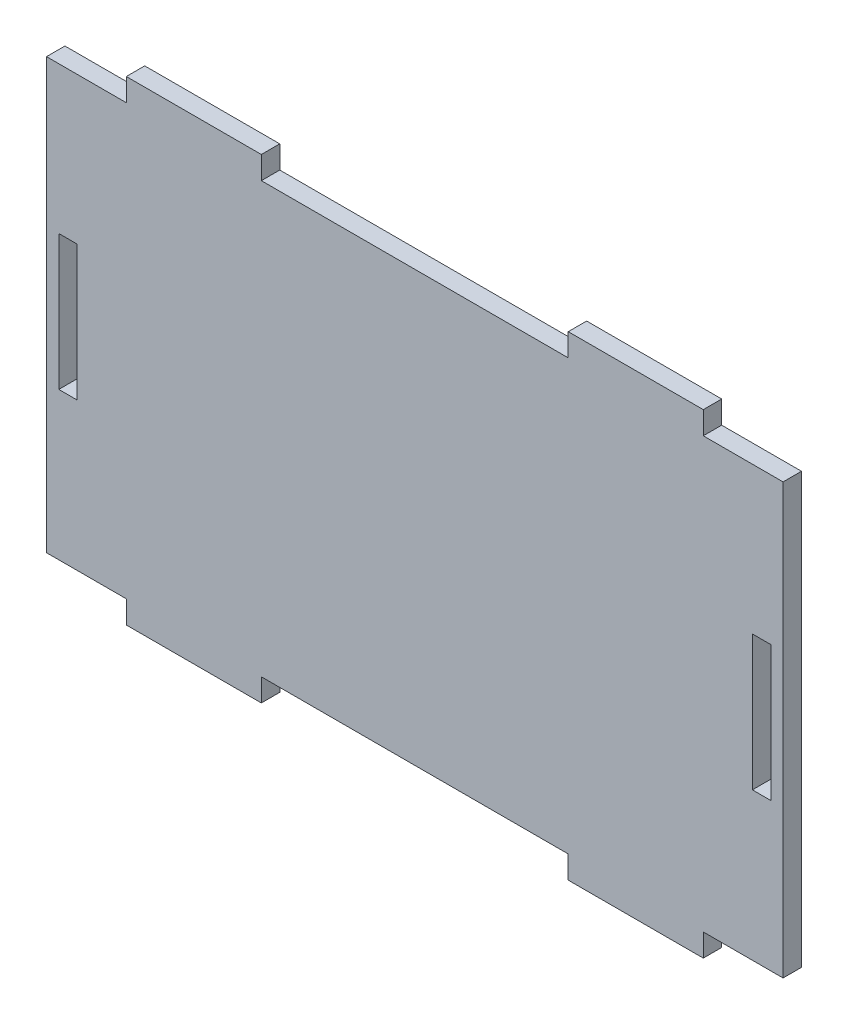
SolidWorks part; units mm, degrees
ref_plane "Front Plane" through (0, 0, 0) normal (0, 0, 1) x (1, 0, 0)
ref_plane "Top Plane" through (0, 0, 0) normal (0, 1, 0) x (1, 0, 0)
ref_plane "Right Plane" through (0, 0, 0) normal (1, 0, 0) x (0, 0, -1)
sketch "Sketch1" plane through (0, 0, 0) normal (0, 0, 1) x (1, 0, 0)
  line L0 (60, 0) -> (60, -17.6209) construction
  line L1 (0, 0) -> (13, 0)
  line L2 (0, 0) -> (0, 70)
  line L3 (0, 70) -> (13, 70)
  line L4 (120, 0) -> (120, 70)
  line L5 (44.5317, 0) -> (85, 0)
  line L6 (35, 0) -> (44.5317, 0)
  line L7 (13, 0) -> (13, -3.696)
  line L8 (35, -3.696) -> (13, -3.696)
  line L9 (35, 0) -> (35, -3.696)
  line L10 (0, 35) -> (5, 35) construction
  line L11 (85, 0) -> (85, -3.696)
  line L12 (85, -3.696) -> (107, -3.696)
  line L13 (107, 0) -> (107, -3.696)
  line L14 (85, 0) -> (75.4683, 0)
  line L15 (107, 0) -> (120, 0)
  line L16 (107, 70) -> (107, 73.696)
  line L17 (85, 73.696) -> (107, 73.696)
  line L18 (85, 70) -> (85, 73.696)
  line L19 (13, 70) -> (13, 73.696)
  line L20 (35, 70) -> (35, 73.696)
  line L21 (35, 73.696) -> (13, 73.696)
  line L22 (35, 70) -> (85, 70)
  line L23 (107, 70) -> (120, 70)
  line L24 (60, 70) -> (60, 0) construction
  line L25 (2, 46.0461) -> (5, 46.0461)
  line L26 (2, 46.0461) -> (2, 24.0461)
  line L27 (2, 24.0461) -> (5, 24.0461)
  line L28 (5, 46.0461) -> (5, 24.0461)
  line L29 (118, 46.0461) -> (115, 46.0461)
  line L30 (118, 46.0461) -> (118, 24.0461)
  line L31 (115, 46.0461) -> (115, 24.0461)
  line L32 (118, 24.0461) -> (115, 24.0461)
  point P31 (118, 24.0461)
  dimension "D1" = 120
  dimension "D2" = 70
  dimension "D3" = 25
  dimension "D4" = 22
  dimension "D5" = 22
  dimension "D6" = 3
  dimension "D7" = 2
extrude "Boss-Extrude1" add sketch "Sketch1" along normal blind 3 contours L23 L16 L17 L18 L22 L20 L21 L19 L3 L2 L1 L7 L8 L9 L6 L5 L11 L12 L13 L15 L4 L25 L28 L27 L26 L30 L32 L31 L29
